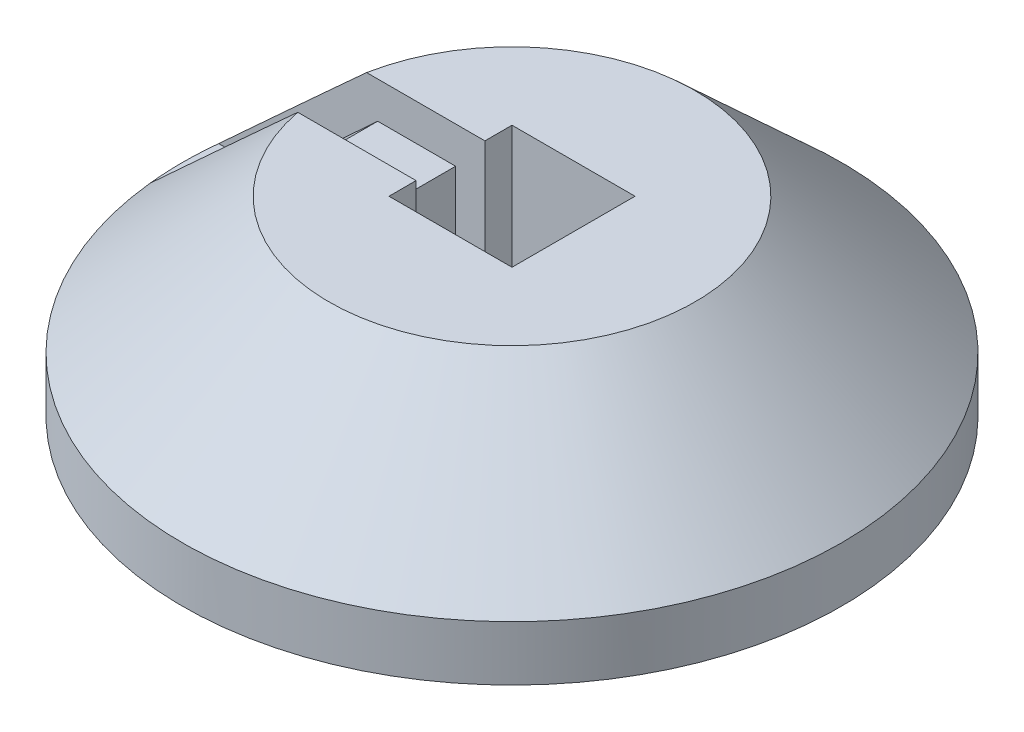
SolidWorks part; units mm, degrees
ref_plane "Front Plane" through (0, 0, 0) normal (0, 0, 1) x (1, 0, 0)
ref_plane "Top Plane" through (0, 0, 0) normal (0, 1, 0) x (1, 0, 0)
ref_plane "Right Plane" through (0, 0, 0) normal (1, 0, 0) x (0, 0, -1)
sketch "Sketch1" plane through (0, 0, 0) normal (0, 0, 1) x (1, 0, 0)
  line L0 (0, 66.04) -> (0, -96.6976) construction
  line L1 (0, 66.04) -> (-63.5, 66.04)
  line L3 (-63.5, 0) -> (0, 0)
  line L4 (0, 66.04) -> (0, 0)
  line L6 (-114.3, 19.05) -> (-114.3, 0)
  line L7 (-114.3, 0) -> (-63.5, 0)
  line L8 (-114.3, 19.05) -> (-63.5, 66.04)
  dimension "D1" = 66.04
  dimension "D2" = 63.5
  dimension "D3" = 19.05
  dimension "D4" = 50.8
  dimension "D5" = 50.8
revolve "Revolve1" add sketch "Sketch1" angle 360 about L0
sketch "Sketch2" plane through (0, 66.04, 0) normal (0, 1, 0) x (1, 0, 0)
  line L0 (-52.5296, 0) -> (48.5109, 0) construction
  line L1 (-21.336, -21.336) -> (21.336, -21.336)
  line L2 (-21.336, -21.336) -> (-21.336, 21.336)
  line L3 (-21.336, 21.336) -> (21.336, 21.336)
  line L4 (21.336, -21.336) -> (21.336, 21.336)
  line L5 (-21.336, -21.336) -> (21.336, 21.336) construction
  line L6 (-21.336, 21.336) -> (21.336, -21.336) construction
  line L7 (-31.496, -11.938) -> (-21.336, -11.938)
  line L8 (-31.496, -11.938) -> (-31.496, 11.938)
  line L9 (-31.496, 11.938) -> (-21.336, 11.938)
  line L10 (-21.336, -11.938) -> (-21.336, 11.938)
  line L11 (-31.496, -11.938) -> (-21.336, 11.938) construction
  line L12 (-31.496, 11.938) -> (-21.336, -11.938) construction
  point P0 (0, 0)
  point P6 (-26.416, 0)
  dimension "D1" = 42.672
  dimension "D2" = 10.16
  dimension "D3" = 23.876
extrude "Cut-Extrude1" cut sketch "Sketch2" against normal blind 59.944 contours L1 L4 L3 L2 | L8 L9 L10 L7
sketch "Sketch3" plane through (0, 0, 0) normal (0, 0, 1) x (1, 0, 0)
  line L0 (-26.416, 66.04) -> (-63.5, 66.04)
  line L1 (-31.496, 66.04) -> (-21.336, 66.04) construction
  line L2 (-63.5, 66.04) -> (-114.3, 19.05)
  line L3 (-63.5, 66.04) -> (-114.3, 19.05) construction
  line L4 (-26.416, 53.34) -> (-58.5269, 53.34)
  line L5 (-58.5269, 53.34) -> (-95.5972, 19.05)
  line L6 (-26.416, 66.04) -> (-26.416, 53.34)
  line L7 (-114.3, 19.05) -> (-95.5972, 19.05)
  line L8 (-114.3, 19.05) -> (114.3, 19.05) construction
  line L9 (-58.5269, 53.34) -> (-105.6762, 9.7269) construction
  dimension "D1" = 12.7
extrude "Cut-Extrude2" cut sketch "Sketch3" along normal mid plane 23.876
